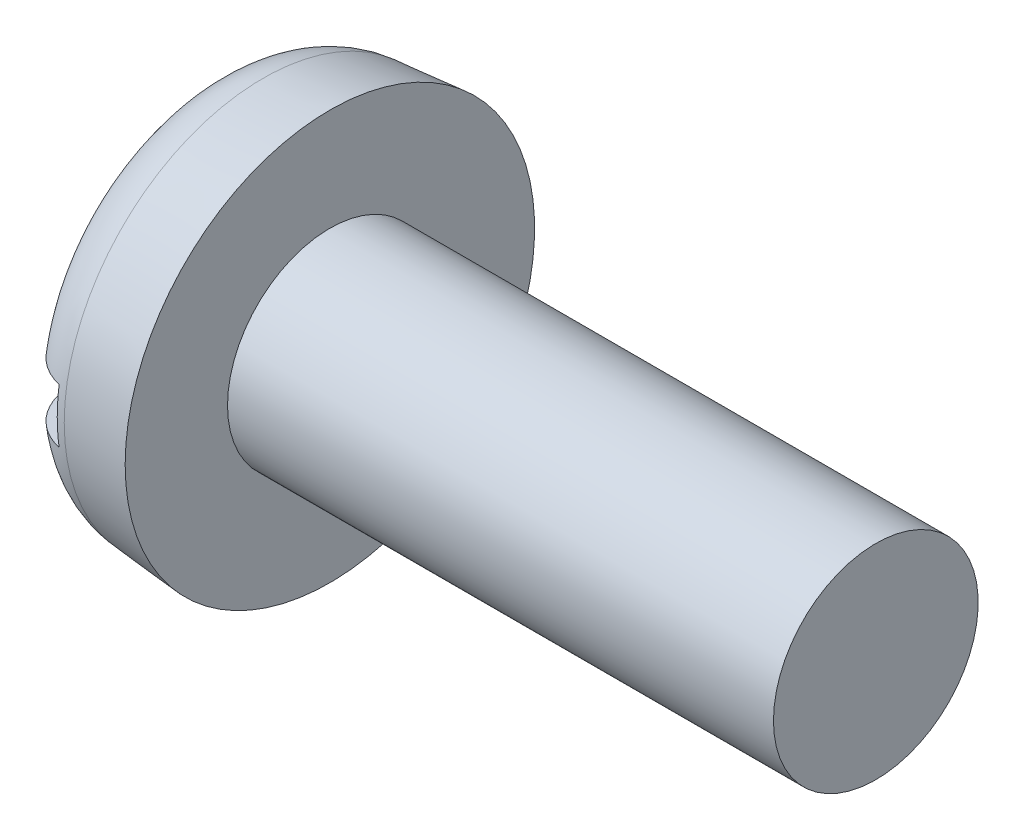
SolidWorks part; units mm, degrees
ref_plane "Plane1" through (0, 0, 0) normal (0, 0, 1) x (1, 0, 0)
ref_plane "Plane2" through (0, 0, 0) normal (0, 1, 0) x (1, 0, 0)
ref_plane "Plane3" through (0, 0, 0) normal (1, 0, 0) x (0, 0, -1)
sketch "BodySke" plane through (0, 0, 0) normal (0, 0, 1) x (1, 0, 0)
  line L0 (3.6, 3) -> (3.6, 6)
  line L1 (0, 0) -> (0, 5.685)
  line L2 (-25.4, 0) -> (127, 0) construction
  line L3 (19.6, 0) -> (0, 0)
  line L4 (3.6, 3) -> (19.6, 3)
  line L5 (19.6, 3) -> (19.6, 0)
  line L6 (0, 5.685) -> (3.6, 6)
  line L9 (4.6, 4.5875) -> (4.6, -4.9375) construction
  line L10 (3.6, 6.35) -> (3.6, -3.175) construction
  dimension "Head_ht" = 3.6
  dimension "Diameter" = 6
  dimension "Length" = 16
  dimension "Head_dia" = 12
  dimension "Advance" = 1
  dimension "Thread_nom" = 16
  dimension "Head_side_angle" = 5
revolve "Base-Revolve" add sketch "BodySke"
fillet "Fillet1" [suppressed] radius 0.25
fillet "Fillet2" radius 1.8 1 edges at (0, 0, 5.685)
sketch "Sketch2" plane through (0, 0, 0) normal (1, 0, 0) x (0, 0, -1)
  line L0 (6, -0.8) -> (-6, -0.8)
  line L1 (6, -0.8) -> (6, 0.8)
  line L2 (-6, 0.8) -> (6, 0.8)
  line L3 (-6, 0.8) -> (-6, -0.8)
  dimension "D1" = 12
  dimension "D2" = 6
  dimension "Slot_width" = 1.6
  dimension "D3" = 0.8
extrude "Slot" cut sketch "Sketch2" along normal blind 1.4
sketch "ThdSchSke" plane through (0, 0, 0) normal (0, 0, 1) x (1, 0, 0)
  line L0 (5.6, -2.4455) -> (5.2117, -3)
  line L1 (5.6, -2.4455) -> (5.9883, -3)
  line L2 (5.9883, -3) -> (5.9883, -3.75)
  line L3 (-3.175, 0) -> (5.1513, 0) construction
  line L5 (5.9883, -3.75) -> (5.2117, -3.75)
  line L6 (5.2117, -3.75) -> (5.2117, -3)
  dimension "Thread_minor" = 4.891
  dimension "Diameter" = 6
  dimension "Start" = 5.6
  dimension "SideAngle" = 55
  dimension "VeeAngle" = 70
  dimension "Overcut" = 7.5
revolve "ThreadSchematic" [suppressed] cut sketch "ThdSchSke" angle 360 about L3
pattern_linear "ThdSchPat" [suppressed]
equation "\"D1@Sketch2\" = \"Head_dia@BodySke\""
equation "\"D2@Sketch2\" = \"D1@Sketch2\" / 2"
equation "\"D3@Sketch2\" = \"Slot_width@Sketch2\" / 2"
equation "\"Thread_length@ThreadCosmetic\" = ((sgn( (\"Length@BodySke\" - \"Advance@BodySke\" * 2.0 ) - \"Thread_nom@BodySke\" )-1)*( (\"Length@BodySke\" - \"Advance@BodySke\"  * 2.0) - \"Thread_nom@BodySke\" ))/-2+ \"Thread_"
equation "\"Thread_minor@ThdSchSke\" = \"Thread_minor@ThreadCosmetic\""
equation "\"Diameter@ThdSchSke\" = \"Diameter@BodySke\""
equation "\"Overcut@ThdSchSke\" = \"Diameter@BodySke\" * 1.25"
equation "\"Start@ThdSchSke\" = \"Head_ht@BodySke\" + \"Length@BodySke\" - \"Thread_length@ThreadCosmetic\"  '---Non-countersunk---"
equation "\"Num_threads@ThdSchPat\" = int( \"Thread_length@ThreadCosmetic\" / \"Advance@BodySke\" + 0.999 )  + 1"
equation "\"Advance@ThdSchPat\" = \"Thread_length@ThreadCosmetic\" /  (\"Num_threads@ThdSchPat\" - 1) 'relax it"
